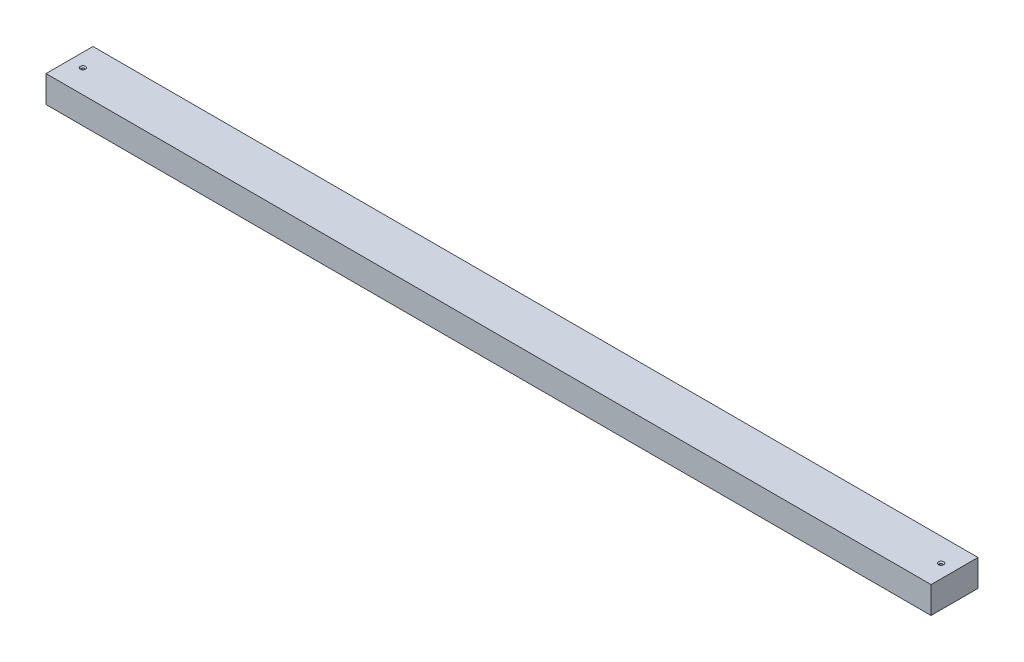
SolidWorks part; units mm, degrees
ref_plane "Front Plane" through (0, 0, 0) normal (0, 0, 1) x (1, 0, 0)
ref_plane "Top Plane" through (0, 0, 0) normal (0, 1, 0) x (1, 0, 0)
ref_plane "Right Plane" through (0, 0, 0) normal (1, 0, 0) x (0, 0, -1)
sketch "Sketch1" plane through (0, 0, 0) normal (0, 1, 0) x (1, 0, 0)
  line L1 (-838.2, 44.45) -> (838.2, 44.45)
  line L2 (-838.2, 44.45) -> (-838.2, -44.45)
  line L3 (-838.2, -44.45) -> (838.2, -44.45)
  line L4 (838.2, 44.45) -> (838.2, -44.45)
  line L5 (-838.2, 44.45) -> (838.2, -44.45) construction
  line L6 (-838.2, -44.45) -> (838.2, 44.45) construction
  point P0 (0, 0)
  dimension "D1" = 1676.4
  dimension "D2" = 88.9
extrude "Boss-Extrude1" add sketch "Sketch1" along normal blind 50.8
sketch "Sketch2" plane through (0, 50.8, 0) normal (0, 1, 0) x (1, 0, 0)
  line L0 (-838.2, -44.45) -> (838.2, -44.45) construction
  line L1 (-838.2, 44.45) -> (-838.2, -44.45) construction
  line L2 (838.2, -44.45) -> (838.2, 44.45) construction
  point P0 (-812.8, 0)
  point P1 (812.8, 0)
  dimension "D1" = 44.45
  dimension "D2" = 25.4
  dimension "D3" = 25.4
hole_wizard "CSK for #10 Flat Head Machine Screw (100)1" positions "Sketch3" profile "Sketch4" countersink size "#10" standard "ANSI Inch"
sketch "Sketch3" plane through (0, 50.8, 0) normal (0, 1, 0) x (1, 0, 0)
  point P0 (-812.8, 0)
  point P3 (812.8, 0)
sketch "Sketch4" plane through (-812.8, 50.8, 0) normal (1, 0, 0) x (0, 0, 1)
  line L0 (0, 0) -> (0, 52.3338)
  line L1 (0, 52.3338) -> (2.5527, 50.8)
  line L2 (2.5527, 50.8) -> (2.5527, 1.9608)
  line L3 (2.5527, 1.9608) -> (4.8895, 0)
  line L5 (4.8895, 0) -> (0, 0)
  line L6 (-2.5527, 1.9608) -> (-4.8895, 0) construction
  line L10 (0, 52.3338) -> (-2.5527, 50.8) construction
  line L11 (0, -6.35) -> (0, 107.95) construction
  dimension "Hole Dia." = 5.1054
  dimension "Hole Depth" = 50.8
  dimension "Near C'Sink Dia." = 9.779
  dimension "Near C'Sink Angle" = 100
  dimension "Drill Angle" = 118
